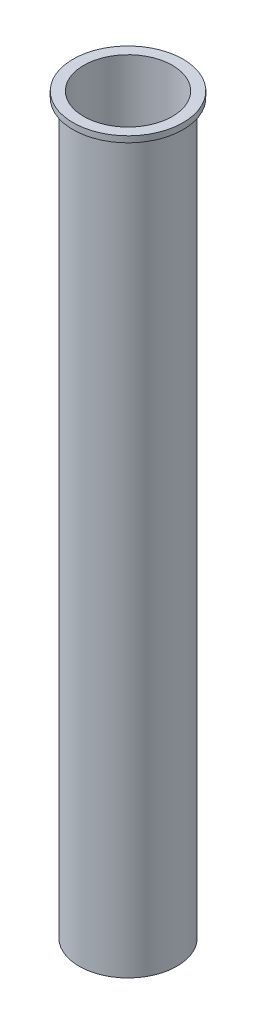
SolidWorks part; units mm, degrees
ref_plane "Front Plane" through (0, 0, 0) normal (0, 0, 1) x (1, 0, 0)
ref_plane "Top Plane" through (0, 0, 0) normal (0, 1, 0) x (1, 0, 0)
ref_plane "Right Plane" through (0, 0, 0) normal (1, 0, 0) x (0, 0, -1)
sketch "Sketch2" plane through (0, 0, 0) normal (1, 0, 0) x (0, 0, -1)
  line L0 (0, 0) -> (0, 126.7883) construction
  line L1 (92.075, 0) -> (114.3, 0)
  line L2 (114.3, 0) -> (114.3, -12.7)
  line L3 (114.3, -12.7) -> (101.6, -12.7)
  line L4 (101.6, -12.7) -> (101.6, -1524)
  line L5 (101.6, -1524) -> (96.5234, -1524)
  line L7 (12.7, -1460.5) -> (12.7, -1447.8)
  line L8 (12.7, -1447.8) -> (92.075, -1447.8)
  line L9 (92.075, -1447.8) -> (92.075, 0)
  spline S0 degree 3 poles (12.7, -1460.5) (12.7, -1481.2613) (25.1026, -1525.2147) (71.1785, -1524) (96.5234, -1524) knots 0 0 0 0 0.444656 1 1 1 1
  dimension "D1" = 12.7
  dimension "D2" = 1524
  dimension "D3" = 9.525
  dimension "D4" = 228.6
  dimension "D5" = 203.2
  dimension "D6" = 25.4
  dimension "D7" = 12.7
  dimension "D8" = 76.2
revolve "Revolve8" add sketch "Sketch2" angle 360 about L0
